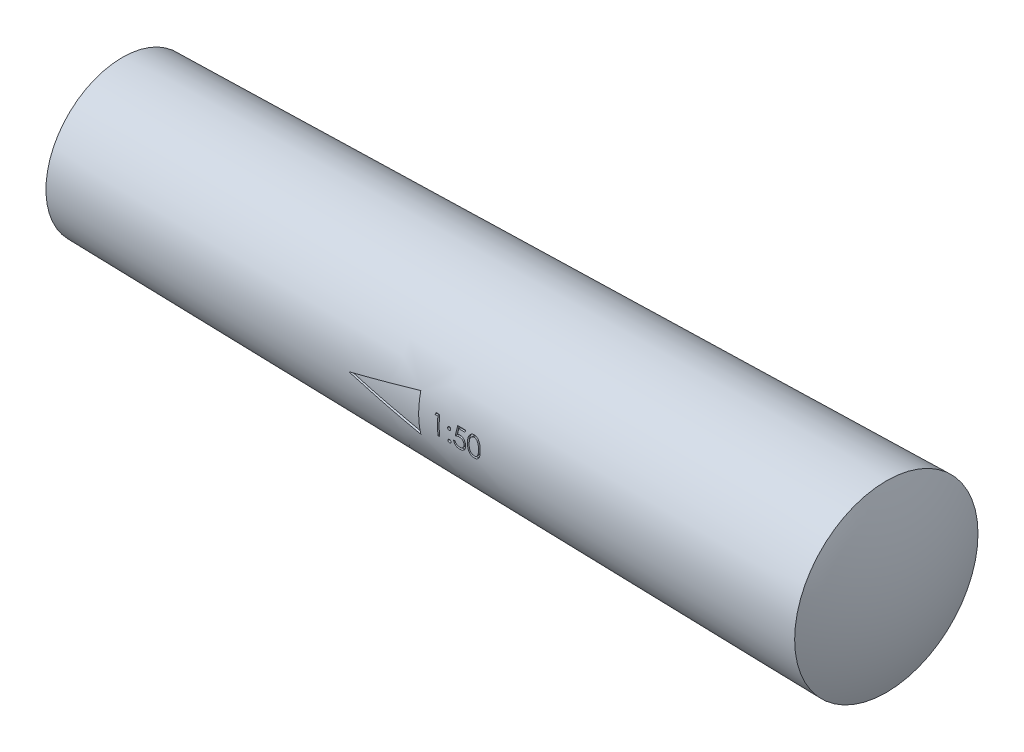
SolidWorks part; units mm, degrees
ref_plane "Front Plane" through (0, 0, 0) normal (0, 0, 1) x (1, 0, 0)
ref_plane "Top Plane" through (0, 0, 0) normal (0, 1, 0) x (1, 0, 0)
ref_plane "Right Plane" through (0, 0, 0) normal (1, 0, 0) x (0, 0, -1)
sketch "Sketch1" plane through (0, 0, 0) normal (1, 0, 0) x (0, 0, -1)
  circle A0 centre (0, 0) radius 4
  dimension "D1" = 8
extrude "Extrude1" add sketch "Sketch1" along normal mid plane 40
draft "Draft1" type of draft neutral plane draft angle 1.146 faces to draft 1 parameters "D1"=1.146
sketch "Sketch2" plane through (0, 0, 0) normal (0, 0, 1) x (1, 0, 0)
  line L0 (-20, 0) -> (-20, 4)
  line L1 (-20, 4) -> (-20, -4) construction
  line L2 (-20, 0) -> (-21, 0)
  line L3 (-21, 0) -> (-21, -4.4) construction
  line L4 (20, 0) -> (20, 4.8)
  line L5 (20, -4.8) -> (20, 4.8) construction
  line L6 (20, 0) -> (21, 0)
  line L7 (21, 0) -> (21, -4.4) construction
  line L8 (-20, -4) -> (20, -4.8) construction
  arc A0 (-21, 0) -> (-20, 4) centre (-12.5, 0) cw
  arc A1 (21, 0) -> (20, 4.8) centre (8.9799, 0) ccw
  point P14 (0, -4.4)
revolve "Revolve1" add sketch "Sketch2" angle 360 about L2
sketch "Sketch5" plane through (0, 0, 0) normal (0, 0, 1) x (1, 0, 0)
  line L0 (0, 4.4) -> (0, -4.4) construction
  line L1 (20, 4.8) -> (-20, 4) construction
  line L2 (-20, -4) -> (20, -4.8) construction
ref_plane "Plane2" through (0, 0, 0) normal (-0.02, 0, 0.9998) x (0.9998, 0, 0.02)
sketch "Sketch6" plane through (0, 0, 0) normal (-0.02, 0, 0.9998) x (0.9998, 0, 0.02)
  line L0 (0, 0) -> (0, 1)
  line L1 (0, 4.4) -> (0, -4.4) construction
  line L2 (0, 1) -> (-3.7321, 0)
  line L3 (-3.7321, 0) -> (0, -1)
  line L4 (0, -1) -> (0, 0)
  line L5 (0, -0.5) -> (4, -0.5) construction
  text T0 "1:50" font "Century Gothic" height 1
  dimension "D1" = 2
  dimension "D2" = 30
  dimension "D3" = 4
wrap "Wrap2" sketch "Sketch6" wrap type deboss source sketch "Sketch6" thickness 0.1 parameters "D1"=0.1
equation "\"D2@Sketch2\" = \"D1@Sketch2\""
